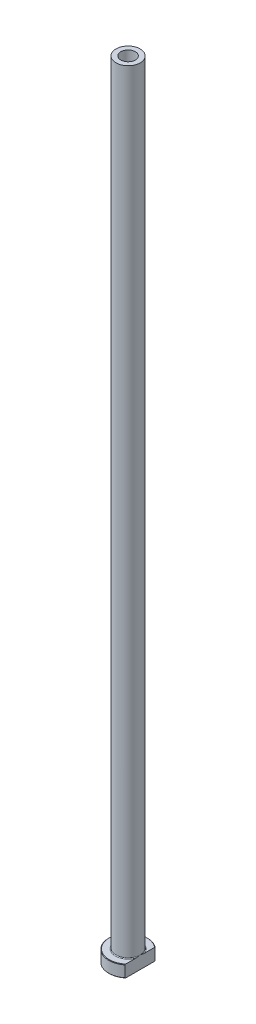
SolidWorks part; units mm, degrees
ref_plane "Front Plane" through (0, 0, 0) normal (0, 0, 1) x (1, 0, 0)
ref_plane "Top Plane" through (0, 0, 0) normal (0, 1, 0) x (1, 0, 0)
ref_plane "Right Plane" through (0, 0, 0) normal (1, 0, 0) x (0, 0, -1)
sketch "Sketch1" plane through (0, 0, 0) normal (0, 0, 1) x (1, 0, 0)
  line L0 (-3, 325) -> (-5, 325)
  line L1 (-5, 325) -> (-5, 5)
  line L2 (-5, 5) -> (-8, 5)
  line L3 (-8, 5) -> (-8, 0)
  line L4 (7.15, 0) -> (-7.15, 0) construction
  line L5 (-8, 0) -> (-3.25, 0)
  line L6 (-3, 280) -> (-3, 325)
  line L7 (0, 92.1877) -> (0, -15.5353) construction
  line L8 (0, -8.8) -> (0, 8.8) construction
  line L9 (-3, 280) -> (-3.25, 268)
  line L10 (-3.25, 268) -> (-3.25, 0)
  dimension "D1" = 0.25
  dimension "ID" = 6
  dimension "OD" = 10
  dimension "L" = 325
  dimension "H" = 16
  dimension "T" = 5
  dimension "N" = 45
  dimension "D2" = 12
  dimension "L-N" = 280
revolve "Revolve1" add sketch "Sketch1" angle 360 about L7
fillet "Fillet1" radius 0.3 1 edges at (0, 5, 5)
chamfer "Chamfer1" distance 0.2 angle 45 2 edges at (0, 5, 8) (0, 0, 8)
sketch "Sketch2" plane through (0, 0, 0) normal (0, -1, 0) x (1, 0, 0)
  line L0 (5, 6.245) -> (5, -6.245)
  circle A0 centre (0, 0) radius 8 construction
  arc A1 (5, 6.245) -> (5, -6.245) centre (0, 0) cw
  circle A2 centre (0, 0) radius 5 construction
extrude "Cut-Extrude1" cut sketch "Sketch2" against normal through all
chamfer "Chamfer2" distance 0.5 angle 45 1 edges at (0, 0, 3.25)
